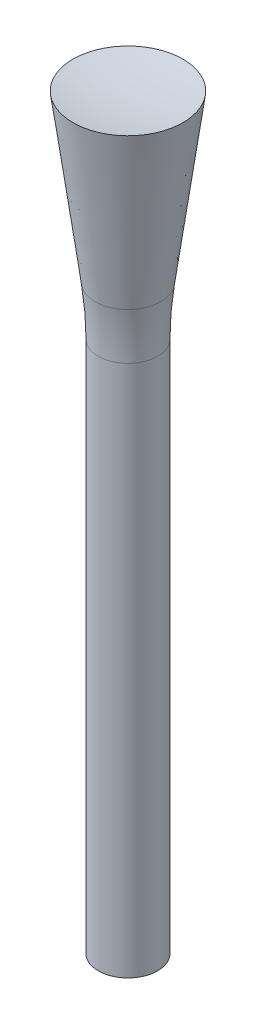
SolidWorks part; units mm, degrees
ref_plane "Front Plane" through (0, 0, 0) normal (0, 0, 1) x (1, 0, 0)
ref_plane "Top Plane" through (0, 0, 0) normal (0, 1, 0) x (1, 0, 0)
ref_plane "Right Plane" through (0, 0, 0) normal (1, 0, 0) x (0, 0, -1)
sketch "Sketch2" plane through (0, 0, 0) normal (0, 0, 1) x (1, 0, 0)
  line L0 (0, 0) -> (0, -100)
  line L2 (-4, -25) -> (-7.4096, 0.6483)
  line L3 (-4, -25) -> (-4, -100)
  line L4 (-4, -100) -> (0, -100)
  arc A0 (0, 0) -> (-7.4096, 0.6483) centre (0, 42.67) cw
  dimension "D1" = 42.67
  dimension "D4" = 25
  dimension "D2" = 100
  dimension "D3" = 4
  dimension "D5" = 10
revolve "Revolve1" add sketch "Sketch2" angle 360 about L0
fillet "Fillet1" radius 50 1 edges at (-4, -25, 0)
